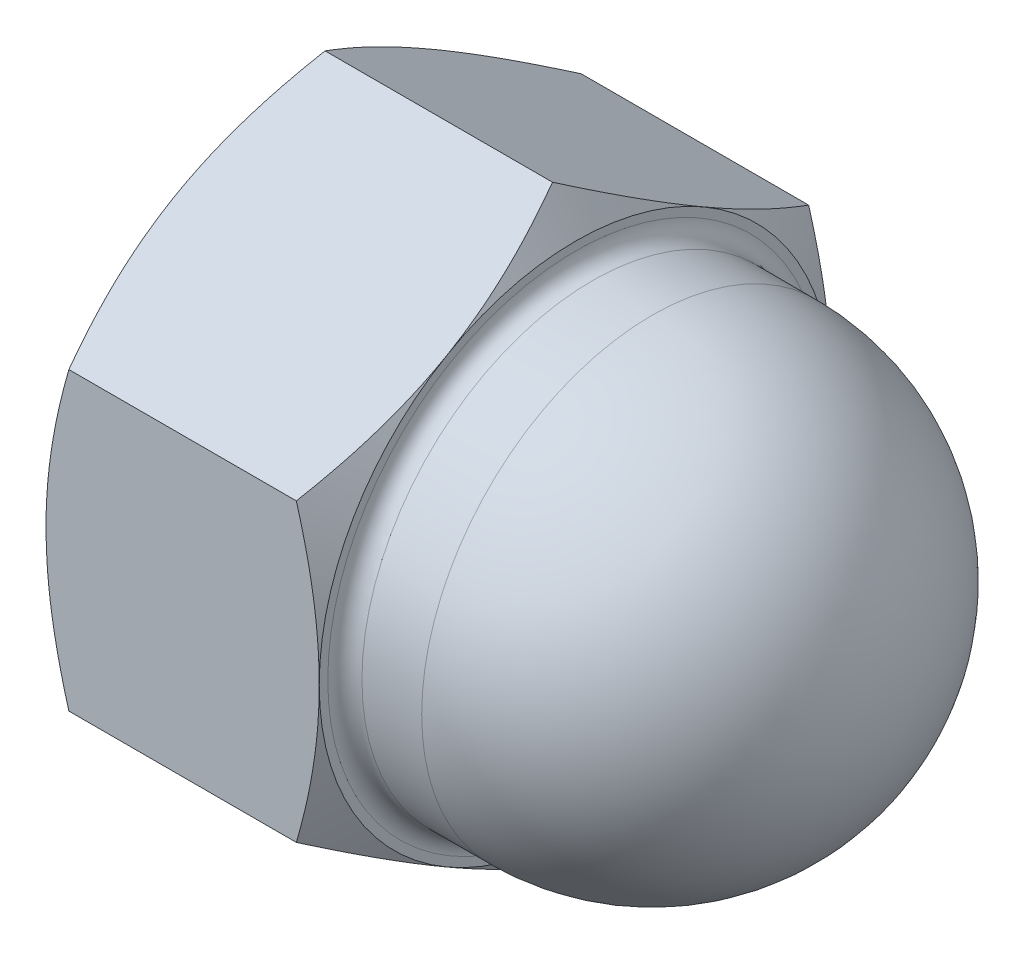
SolidWorks part; units mm, degrees
ref_plane "Plane1" through (0, 0, 0) normal (0, 0, 1) x (1, 0, 0)
ref_plane "Plane2" through (0, 0, 0) normal (0, 1, 0) x (1, 0, 0)
ref_plane "Plane3" through (0, 0, 0) normal (1, 0, 0) x (0, 0, -1)
sketch "BaseNutSke" plane through (0, 0, 0) normal (1, 0, 0) x (0, 0, -1)
  line L6 (15, 8.6603) -> (15, -8.6603)
  line L7 (-15, 8.6603) -> (-15, -8.6603)
  line L8 (15, 8.6603) -> (0, 17.3205)
  line L9 (0, 17.3205) -> (-15, 8.6603)
  line L10 (-15, -8.6603) -> (0, -17.3205)
  line L11 (0, -17.3205) -> (15, -8.6603)
  dimension "D4" = 60
  dimension "D1" = 120
  dimension "D2" = 15
  dimension "D3" = 15
  dimension "Width_flats" = 30
extrude "BaseNut" add sketch "BaseNutSke" along normal blind 16
sketch "DomeSke" plane through (0, 0, 0) normal (0, 0, 1) x (1, 0, 0)
  line L0 (0, 0) -> (63.5, 0) construction
  line L1 (0, 8.6603) -> (0, -8.6603) construction
  line L2 (34, 0) -> (0, 0)
  line L3 (0, 13.5) -> (20.5, 13.5)
  line L4 (0, -13.5) -> (22.225, -13.5) construction
  line L5 (0, 13.5) -> (0, 0)
  arc A0 (20.5, 13.5) -> (34, 0) centre (20.5, 0) cw
  dimension "Dome_rad" = 13.5
  dimension "Overall_ht" = 34
revolve "Dome" add sketch "DomeSke" angle 360 about L0
sketch "Sketch4" plane through (0, 0, 0) normal (0, 0, 1) x (1, 0, 0)
  line L0 (0, 15) -> (2.7831, 19.8205)
  line L1 (16, 15) -> (13.2169, 19.8205)
  line L2 (2.7831, 19.8205) -> (13.2169, 19.8205)
  line L3 (16, 15) -> (18, 15)
  line L4 (18, 15) -> (18, 30)
  line L5 (18, 30) -> (-2, 30)
  line L6 (0, 15) -> (-2, 15)
  line L7 (-2, 15) -> (-2, 30)
  line L8 (16, 17.3205) -> (16, 8.6603) construction
  line L9 (0, 17.3205) -> (0, 8.6603) construction
  line L10 (0, 0) -> (57.15, 0) construction
  line L11 (16, 17.3205) -> (0, 17.3205) construction
  point P17 (16, 15)
  dimension "D1" = 30
  dimension "D2" = 30
  dimension "D3" = 2
  dimension "D4" = 2
  dimension "D5" = 2.5
  dimension "D6" = 15
  dimension "D7" = 15
revolve "DoubleChamfer" cut sketch "Sketch4" angle 360 about L10
sketch "TapDriSke" plane through (0, 0, 0) normal (0, 0, 1) x (1, 0, 0)
  line L0 (0, 0) -> (44.45, 0) construction
  line L1 (0, 8.75) -> (27, 8.75)
  line L2 (0, 12.9904) -> (0, 0) construction
  line L3 (27, 8.75) -> (32.2575, 0)
  line L4 (0, 0) -> (63.5, 0) construction
  line L5 (32.2575, 0) -> (0, 0)
  line L6 (0, 0) -> (0, 8.75)
  line L7 (27, -8.75) -> (32.2575, 0) construction
  line L8 (0, -8.75) -> (27, -8.75) construction
  line L9 (0.5, 6.35) -> (0.5, 3.175) construction
  dimension "TPA" = 118
  dimension "Thread_min" = 17.5
  dimension "Drill_depth" = 27
  dimension "Drill_clr" = 1
revolve "TapDrill" cut sketch "TapDriSke"
revolve "EndChamfer" cut sketch "EndChamferSketch" angle 360 about L4
sketch "EndChamferSketch" plane through (0, 0, 0) normal (0, 0, 1) x (1, 0, 0)
  line L0 (-0.0254, 10) -> (0.0254, 10)
  line L1 (0.0254, 10) -> (0.9882, 8.625)
  line L2 (0.9882, 8.625) -> (-0.0254, 8.625)
  line L3 (-0.0254, 8.625) -> (-0.0254, 10)
  line L4 (0, 0) -> (-15.875, 0) construction
  dimension "D1" = 0.0508
  dimension "D2" = 35
  dimension "D3" = 0.0254
  dimension "ChamferDepth" = 1.375
  dimension "ThreadMajor" = 10
sketch "GrvSke" plane through (0, 0, 0) normal (0, 0, 1) x (1, 0, 0)
  line L0 (0, 0) -> (38.1, 0) construction
  line L1 (16, 10.5) -> (16, 7.75)
  line L2 (16, 7.75) -> (22, 7.75)
  line L3 (22, 7.75) -> (22, 10.5)
  line L4 (22, 10.5) -> (16, 10.5)
  line L5 (16, 0) -> (16, 12.9904) construction
  line L6 (27, 8.75) -> (0, 8.75) construction
  dimension "D1" = 1
  dimension "Groove_wid" = 6
  dimension "Groove_dia" = 21
revolve "Groove" cut sketch "GrvSke" angle 360 about L0
sketch "ThdSchSke" plane through (0, 0, 0) normal (0, 1, 0) x (1, 0, 0)
  line L0 (0.0381, 10) -> (-0.8372, 8.75)
  line L1 (-0.8372, 8.75) -> (-0.8372, 4.375)
  line L2 (-0.8372, 4.375) -> (0.9134, 4.375)
  line L3 (0.9134, 4.375) -> (0.9134, 8.75)
  line L4 (0.9134, 8.75) -> (0.0381, 10)
  line L5 (-38.1, 0) -> (3.175, 0) construction
  line L6 (0, 0) -> (-15.875, 0) construction
  line L7 (0, 0) -> (63.5, 0) construction
  line L9 (2.5381, 0.475) -> (2.5381, -5.875) construction
  dimension "D1" = 0.0381
  dimension "VeeAngle" = 70
  dimension "SideAngle" = 55
  dimension "Thread_major" = 20
  dimension "Tap_drill" = 17.5
  dimension "OverCut" = 8.75
  dimension "Advance" = 2.5
revolve "ThreadSchematic" [suppressed] cut sketch "ThdSchSke" angle 360 about L5
pattern_linear "ThdSchPat" [suppressed]
fillet "DomeFillet" radius 1 1 edges at (16, 0, 13.5)
equation "' \"Width_flats@BaseNutSke\" = 30"
equation "' \"Hex_ht@BaseNut\" = 16"
equation "' \"Overall_ht@DomeSke\" = 34"
equation "' \"Dome_rad@DomeSke\" = 13.5"
equation "' \"Thread_min@TapDriSke\" = 17.5"
equation "' \"Drill_clr@TapDriSke\" = 1.0"
equation "' \"Advance@ThdSchSke\" = 2.5"
equation "' \"Thread_nominal@ThreadCosmetic\" = 20"
equation "' \"Radius@DomeFillet\" = 1.0"
equation "' \"Groove_wid@GrvSke\" = 6"
equation "\"Drill_depth@TapDriSke\" = \"Overall_ht@DomeSke\"  - \"Drill_clr@TapDriSke\" - 0.3 * \"Thread_nominal@ThreadCosmetic\""
equation "\"Groove_dia@GrvSke\" = \"Thread_nominal@ThreadCosmetic\" * 1.05"
equation "\"Thread_depth@ThreadCosmetic\" = \"Thread_nominal@ThreadCosmetic\""
equation "\"D2@BaseNutSke\" = \"Width_flats@BaseNutSke\" / 2"
equation "\"D3@BaseNutSke\" = \"Width_flats@BaseNutSke\" / 2"
equation "\"D7@Sketch4\" = \"Width_flats@BaseNutSke\" / 2"
equation "\"D5@Sketch4\" = \"Width_flats@BaseNutSke\" / 12"
equation "\"Thread_major@ThdSchSke\" = \"Thread_nominal@ThreadCosmetic\""
equation "\"Tap_drill@ThdSchSke\" = \"Thread_min@TapDriSke\""
equation "\"Overcut@ThdSchSke\" = \"Tap_drill@ThdSchSke\" * 0.5"
equation "\"Num_threads@ThdSchPat\" = int(  ( \"Hex_ht@BaseNut\" - 0.002 ) / \"Advance@ThdSchSke\" + 0.999 )  + 1"
equation "' \"Num_threads@ThdSchPat\" = int(  ( \"Thread_depth@ThreadCosmetic\" - 0.002 ) / \"Advance@ThdSchSke\" + 0.999 )  + 1"
equation "\"Advance@ThdSchPat\" = ( \"Hex_ht@BaseNut\" - 0.002 ) /  (\"Num_threads@ThdSchPat\" - 1) 'relax it"
equation "' \"Advance@ThdSchPat\" = ( \"Thread_depth@ThreadCosmetic\" - 0.002 ) /  (\"Num_threads@ThdSchPat\" - 1) 'relax it"
equation "\"ThreadMajor@EndChamferSketch\" = \"Thread_nominal@ThreadCosmetic\" * 0.5"
equation "\"ChamferDepth@EndChamferSketch\" = (\"Thread_nominal@ThreadCosmetic\" - \"Thread_min@TapDriSke\") * 0.55"
